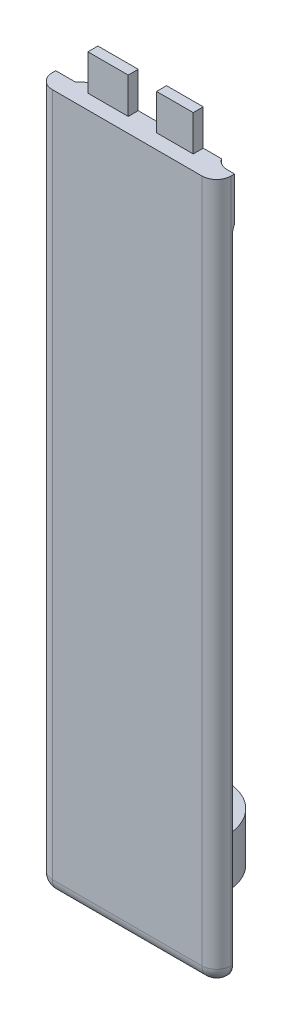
SolidWorks part; units mm, degrees
ref_plane "Front Plane" through (0, 0, 0) normal (0, 0, 1) x (1, 0, 0)
ref_plane "Top Plane" through (0, 0, 0) normal (0, 1, 0) x (1, 0, 0)
ref_plane "Right Plane" through (0, 0, 0) normal (1, 0, 0) x (0, 0, -1)
sketch "Sketch3" plane through (0, 0, 0) normal (0, 0, 1) x (1, 0, 0)
  line L1 (-18.3795, 75.4867) -> (18.3795, 75.4867)
  line L2 (-18.3795, 75.4867) -> (-18.3795, -75.4867)
  line L3 (-18.3795, -75.4867) -> (18.3795, -75.4867)
  line L4 (18.3795, 75.4867) -> (18.3795, -75.4867)
  line L5 (-18.3795, 75.4867) -> (18.3795, -75.4867) construction
  line L6 (-18.3795, -75.4867) -> (18.3795, 75.4867) construction
  point P0 (0, 0)
  dimension "D1" = 150.9734
  dimension "D2" = 36.759
extrude "Boss-Extrude5" add sketch "Sketch3" along normal blind 5.08
sketch "Sketch4" plane through (0, -75.4867, 0) normal (0, -1, 0) x (-1, 0, 0)
  line L0 (-18.3795, -5.08) -> (-18.3795, 0) construction
  line L1 (18.3795, 0) -> (-18.3795, 0)
  line L2 (18.3795, 0) -> (18.3795, -1.7859)
  line L3 (18.3795, -1.7859) -> (-18.3795, -1.7859)
  line L4 (-18.3795, 0) -> (-18.3795, -1.7859)
extrude "Cut-Extrude1" cut sketch "Sketch4" against normal blind 135.89
sketch "Sketch5" plane through (0, 75.4867, 0) normal (0, 1, 0) x (1, 0, 0)
  line L0 (-18.3795, -5.08) -> (-18.3795, 0) construction
  line L1 (18.3795, -5.08) -> (-18.3795, -5.08)
  line L2 (18.3795, -5.08) -> (18.3795, -2.0583)
  line L3 (18.3795, -2.0583) -> (-18.3795, -2.0583)
  line L4 (-18.3795, -5.08) -> (-18.3795, -2.0583)
extrude "Cut-Extrude2" cut sketch "Sketch5" against normal blind 7.366
sketch "Sketch6" plane through (0, 75.4867, 0) normal (0, 1, 0) x (1, 0, 0)
  line L0 (18.3795, 0) -> (-18.3795, 0) construction
  line L1 (18.3795, -2.0583) -> (10.5706, -2.0583)
  line L2 (18.3795, -2.0583) -> (18.3795, 0)
  line L3 (18.3795, 0) -> (10.5706, 0)
  line L4 (10.5706, -2.0583) -> (10.5706, 0)
extrude "Cut-Extrude3" cut sketch "Sketch6" against normal blind 7.366
sketch "Sketch7" plane through (0, 75.4867, 0) normal (0, 1, 0) x (1, 0, 0)
  line L0 (10.5706, -2.0583) -> (-18.3795, -2.0583) construction
  line L1 (-18.3795, 0) -> (-11.079, 0)
  line L2 (-18.3795, 0) -> (-18.3795, -2.0583)
  line L3 (-18.3795, -2.0583) -> (-11.079, -2.0583)
  line L4 (-11.079, 0) -> (-11.079, -2.0583)
extrude "Cut-Extrude4" cut sketch "Sketch7" against normal blind 7.366
sketch "Sketch8" plane through (0, 75.4867, 0) normal (0, 1, 0) x (1, 0, 0)
  line L0 (10.5706, 0) -> (-11.079, 0) construction
  line L4 (3.0284, -2.0583) -> (3.0284, 0)
  line L6 (3.0284, -2.0583) -> (-2.7931, -2.0583)
  line L7 (3.0284, -2.0583) -> (3.0284, 0)
  line L8 (3.0284, 0) -> (-2.7931, 0)
  line L9 (-2.7931, -2.0583) -> (-2.7931, 0)
extrude "Cut-Extrude5" cut sketch "Sketch8" against normal blind 7.366 contours L9 L4 M3 M1
ref_plane "Plane1" through (0, -57.8367, 0) normal (0, -1, 0) x (-1, 0, 0)
sketch "Sketch9" plane through (0, -57.8367, 0) normal (0, -1, 0) x (-1, 0, 0)
  line L0 (0, -5.08) -> (0, -4.02) construction
  line L1 (18.3795, -5.08) -> (-18.3795, -5.08) construction
  circle A0 centre (0.3, 5.92) radius 9.69
  dimension "D1" = 1.06
extrude "Boss-Extrude6" add sketch "Sketch9" along normal blind 10
sketch "Sketch10" plane through (0, 0, 0) normal (0, 0, -1) x (-1, 0, 0)
  line L0 (18.3795, 60.4033) -> (-18.3795, 60.4033) construction
  line L1 (-18.3795, 68.1207) -> (-14.3383, 68.1207)
  line L2 (-18.3795, 68.1207) -> (-18.3795, 60.4033)
  line L3 (-18.3795, 60.4033) -> (-14.3383, 60.4033)
  line L4 (-14.3383, 68.1207) -> (-14.3383, 60.4033)
  line L6 (18.3795, 68.1207) -> (14.3234, 68.1207)
  line L7 (18.3795, 68.1207) -> (18.3795, 60.4033)
  line L8 (18.3795, 60.4033) -> (14.3234, 60.4033)
  line L9 (14.3234, 68.1207) -> (14.3234, 60.4033)
extrude "Cut-Extrude7" cut sketch "Sketch10" against normal blind 1.364
fillet "Fillet4" radius 3 1 edges at (-18.3795, -3.683, 5.08)
fillet "Fillet5" radius 3 1 edges at (18.3795, -3.683, 5.08)
fillet "Fillet6" radius 3 5 edges at (-18.3795, -75.4867, 1.9329) (-17.5008, -75.4867, 4.2013) (18.3795, -75.4867, 1.9329) (17.5008, -75.4867, 4.2013) (0, -75.4867, 5.08)
fillet "Fillet7" radius 3 1 edges at (-0.3, -67.8367, 1.7859)
fillet "Fillet8" radius 3 1 edges at (-0.3, -57.8367, 1.7859)
fillet "Fillet9" radius 3 2 edges at (-6.175, -62.8367, 1.7859) (5.575, -62.8367, 1.7859)
fillet "Fillet11" radius 3 1 edges at (0, 60.4033, 1.7859)
fillet "Fillet12" radius 3 1 edges at (14.3383, 63.6574, 1.364)
fillet "Fillet13" radius 3 1 edges at (-14.3234, 64.262, 0)
